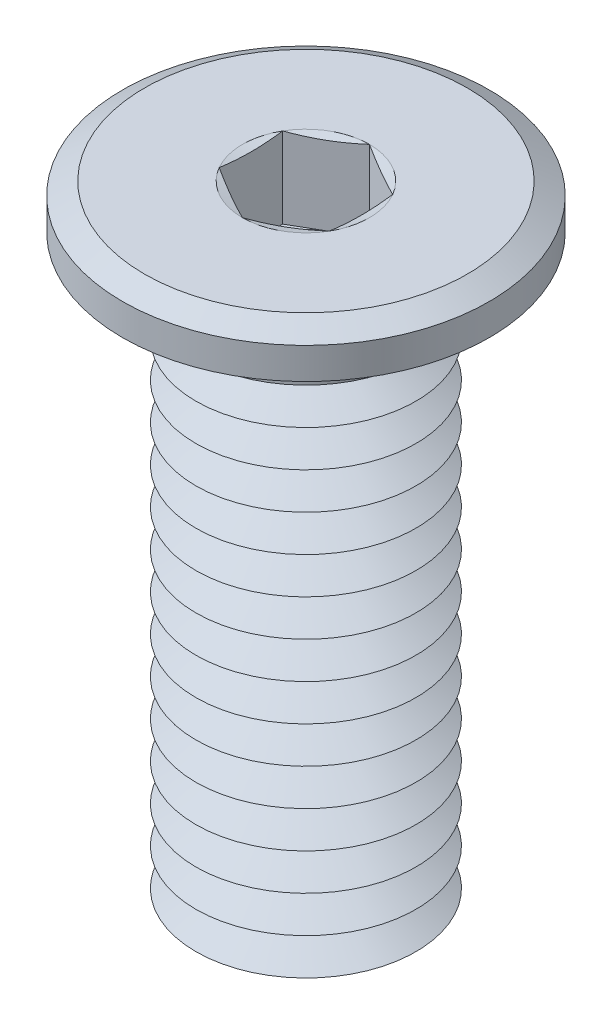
SolidWorks part; units mm, degrees
ref_plane "Front Plane" through (0, 0, 0) normal (0, 0, 1) x (1, 0, 0)
ref_plane "Top Plane" through (0, 0, 0) normal (0, 1, 0) x (1, 0, 0)
ref_plane "Right Plane" through (0, 0, 0) normal (1, 0, 0) x (0, 0, -1)
sketch "Sketch1" plane through (0, 0, 0) normal (0, 1, 0) x (1, 0, 0)
  circle A0 centre (0, 0) radius 5
  dimension "D1" = 10
extrude "Boss-Extrude1" add sketch "Sketch1" against normal blind 1.2
sketch "Sketch2" plane through (0, -1.2, 0) normal (0, -1, 0) x (1, 0, 0)
  circle A0 centre (0, 0) radius 3
  dimension "D1" = 6
extrude "Boss-Extrude2" add sketch "Sketch2" along normal blind 16
sketch "Sketch3" plane through (0, 0, 0) normal (1, 0, 0) x (0, 0, -1)
  line L0 (0, 0.9906) -> (0, -8.2999) construction
sketch "Sketch5" plane through (0, 0, 0) normal (1, 0, 0) x (0, 0, -1)
  line L0 (-3, -17.7) -> (-2.134, -17.2)
  line L1 (-3, -1.2) -> (-3, -17.2) construction
  line L2 (-2.134, -17.2) -> (-3, -16.7)
  line L3 (-3, -1.2) -> (-3, -17.2) construction
  line L4 (-3, -16.7) -> (-3, -17.7)
  line L6 (-3, -1.2) -> (-3, -17.2) construction
  line L7 (-3, -1.2) -> (-3, -17.2) construction
  line L14 (-3, -17.2) -> (3, -17.2) construction
  dimension "D1" = 1
revolve "Cut-Revolve1" cut sketch "Sketch5" angle 360 about L0
pattern_linear "LPattern1" count 15 spacing 1 along (0, 1, 0) of "Cut-Revolve1"
fillet "Fillet1" radius 0.25 1 edges at (0, -1.2, -3)
chamfer "Chamfer2" distance 0.6 angle 30 1 edges at (0, 0, 5)
sketch "Sketch6" plane through (0, 0, 0) normal (0, 1, 0) x (1, 0, 0)
  line L1 (0, 1.7321) -> (-1.5, 0.866)
  line L2 (-1.5, 0.866) -> (-1.5, -0.866)
  line L3 (-1.5, -0.866) -> (0, -1.7321)
  line L4 (0, -1.7321) -> (1.5, -0.866)
  line L5 (1.5, -0.866) -> (1.5, 0.866)
  line L6 (1.5, 0.866) -> (0, 1.7321)
  circle A0 centre (0, 0) radius 1.5 construction
  dimension "D1" = 3
extrude "Cut-Extrude1" cut sketch "Sketch6" against normal blind 2.2
sketch "Sketch7" plane through (0, -2.2, 0) normal (0, 1, 0) x (1, 0, 0)
  line L0 (-1.5, 0.866) -> (-1.5, -0.866) construction
  circle A0 centre (0, 0) radius 1.5
extrude "Cut-Extrude2" cut sketch "Sketch7" against normal through all draft 60
sketch "Sketch8" plane through (0, 0, 0) normal (0, 1, 0) x (1, 0, 0)
  circle A0 centre (0, 0) radius 1.7321
extrude "Cut-Extrude3" cut sketch "Sketch8" against normal through all draft 75
